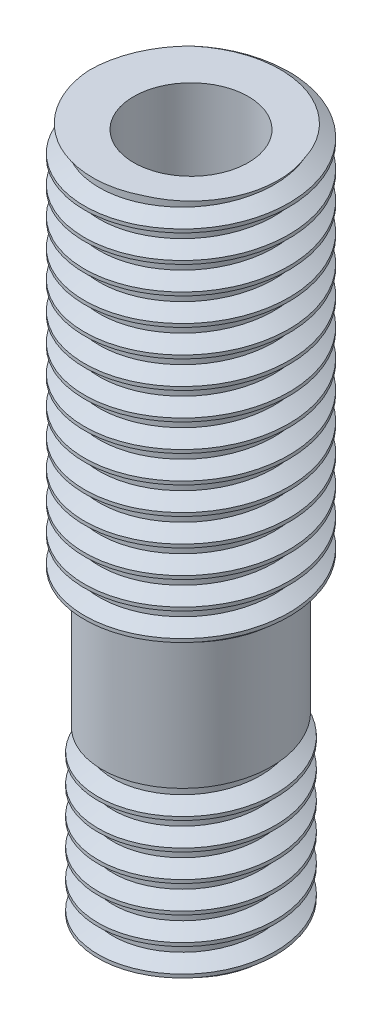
SolidWorks part; units mm, degrees
ref_plane "Front Plane" through (0, 0, 0) normal (0, 0, 1) x (1, 0, 0)
ref_plane "Top Plane" through (0, 0, 0) normal (0, 1, 0) x (1, 0, 0)
ref_plane "Right Plane" through (0, 0, 0) normal (1, 0, 0) x (0, 0, -1)
sketch "Sketch1" plane through (0, 0, 0) normal (1, 0, 0) x (0, 0, -1)
  line L0 (0, 0) -> (0, 18.9565)
  line L1 (2.1, 0) -> (3.25, 0)
  line L2 (2.1, 0) -> (2.1, 25)
  line L3 (2.1, 25) -> (3.75, 25)
  line L4 (3.75, 11) -> (3.75, 25)
  line L5 (0, 11) -> (2.1, 11) construction
  line L6 (2.1, 0) -> (3.25, 0)
  line L7 (0, 0) -> (0, 6)
  line L8 (3.1, 6) -> (3.25, 6)
  line L9 (3.25, 0) -> (3.25, 6)
  line L10 (0, 6) -> (2.1, 6) construction
  line L11 (0, 0) -> (2.1, 0) construction
  line L12 (3.75, 0) -> (3.75, 11) construction
  line L13 (3.1, 6) -> (2.1, 6) construction
  line L14 (3.1, 6) -> (3.1, 11)
  line L15 (3.1, 11) -> (2.1, 11) construction
  line L16 (2.1, 6) -> (2.1, 11)
  line L17 (3.25, 0) -> (3.75, 0) construction
  line L18 (2.1, 6) -> (3.1, 6) construction
  line L19 (2.1, 11) -> (3.1, 11) construction
  line L20 (3.1, 11) -> (3.75, 11)
  line L21 (-3.4853, 11) -> (0, 11) construction
  line L22 (3.75, 11) -> (8.6277, 11) construction
  dimension "D1" = 25
  dimension "D2" = 2.1
  dimension "D3" = 3.75
  dimension "D4" = 3.25
  dimension "D5" = 14
  dimension "D6" = 6
  dimension "D7" = 1
revolve "Revolve1" add sketch "Sketch1" angle 360 about L0
thread "Thread1" pitch 1 start angle 0, offset 1, length 0, pitch 1, diameter 7.5
ref_plane "Plane1" through (-3.75, 26, 0) normal (0, 0, 1) x (-1, 0, 0)
sketch "Thread Profile1" plane through (-3.75, 26, 0) normal (0, 0, 1) x (-1, 0, 0)
  line L0 (0, 0) -> (0, 1) construction
  line L11 (0, 0) -> (0, 0.875)
  line L12 (0, 0.875) -> (-0.5413, 0.5625)
  line L13 (-0.5413, 0.5625) -> (-0.5413, 0.3125)
  line L15 (-0.5413, 0.3125) -> (0, 0)
  line L17 (-0.5413, 0.4375) -> (0, 0.4375) construction
  point P2 (0, 0)
  dimension "Pitch" = 1
  dimension "Profile_Angle" = 60
  dimension "Profile_Land" = 0.25
  dimension "Profile_Height" = 0.5413
thread "Thread2" pitch 1 start angle 0, offset 1, length 0, pitch 1, diameter 6.5
ref_plane "Plane2" through (-3.25, 7, 0) normal (0, 0, 1) x (-1, 0, 0)
sketch "Thread Profile2" plane through (-3.25, 7, 0) normal (0, 0, 1) x (-1, 0, 0)
  line L0 (0, 0) -> (0, 1) construction
  line L11 (0, 0) -> (0, 0.875)
  line L12 (0, 0.875) -> (-0.5413, 0.5625)
  line L13 (-0.5413, 0.5625) -> (-0.5413, 0.3125)
  line L15 (-0.5413, 0.3125) -> (0, 0)
  line L17 (-0.5413, 0.4375) -> (0, 0.4375) construction
  point P2 (0, 0)
  dimension "Pitch" = 1
  dimension "Profile_Angle" = 60
  dimension "Profile_Land" = 0.25
  dimension "Profile_Height" = 0.5413
